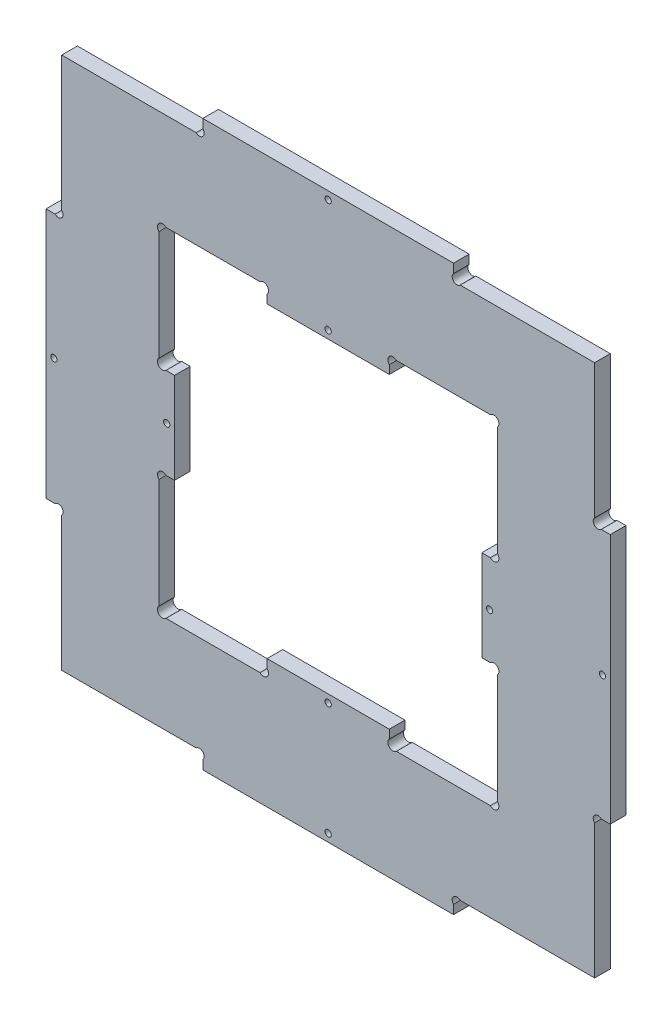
SolidWorks part; units mm, degrees
ref_plane "Plan de face" through (0, 0, 0) normal (0, 0, 1) x (1, 0, 0)
ref_plane "Plan de dessus" through (0, 0, 0) normal (0, 1, 0) x (1, 0, 0)
ref_plane "Plan de droite" through (0, 0, 0) normal (1, 0, 0) x (0, 0, -1)
sketch "Esquisse1" plane through (0, 0, 0) normal (0, 0, 1) x (1, 0, 0)
  line L0 (71.1637, -114.0585) -> (71.1637, -111.1798)
  line L1 (-20.3363, -31.4726) -> (-20.3363, -21.1058) construction
  line L2 (22.9716, -75.5585) -> (35.3801, -75.5585) construction
  line L3 (-28.4521, -38.5585) -> (-1.3302, -38.5585) construction
  line L4 (11.6637, -82.4037) -> (11.6637, -56.2614) construction
  line L5 (-8.8363, 65.9415) -> (71.1637, 65.9415)
  line L6 (-58.8363, 15.9415) -> (-58.8363, -64.0585)
  line L7 (-8.8363, -114.0585) -> (71.1637, -114.0585)
  line L8 (121.1637, 15.9415) -> (121.1637, -64.0585)
  line L9 (73.285, -109.0585) -> (116.1637, -109.0585)
  line L10 (116.1637, -109.0585) -> (116.1637, -66.1798)
  line L11 (118.285, -64.0585) -> (121.1637, -64.0585)
  line L12 (-8.8363, -114.0585) -> (-8.8363, -111.1798)
  line L13 (-10.9576, -109.0585) -> (-53.8363, -109.0585)
  line L14 (-53.8363, -109.0585) -> (-53.8363, -66.1798)
  line L15 (-55.9576, -64.0585) -> (-58.8363, -64.0585)
  line L16 (-58.8363, 15.9415) -> (-55.9576, 15.9415)
  line L17 (-53.8363, 18.0628) -> (-53.8363, 60.9415)
  line L18 (-53.8363, 60.9415) -> (-10.9576, 60.9415)
  line L19 (-8.8363, 63.0628) -> (-8.8363, 65.9415)
  line L20 (71.1637, 65.9415) -> (71.1637, 63.0628)
  line L21 (73.285, 60.9415) -> (116.1637, 60.9415)
  line L22 (116.1637, 60.9415) -> (116.1637, 18.0628)
  line L23 (118.285, 15.9415) -> (121.1637, 15.9415)
  line L24 (-8.8363, 60.9415) -> (-12.1872, 64.2924) construction
  line L25 (71.1637, 60.9415) -> (74.5147, 64.2924) construction
  line L26 (116.1637, 15.9415) -> (119.3654, 19.1431) construction
  line L27 (116.1637, -64.0585) -> (119.1916, -67.0864) construction
  line L28 (71.1637, -109.0585) -> (74.5147, -112.4095) construction
  line L29 (-8.8363, -109.0585) -> (-11.7026, -111.9249) construction
  line L30 (-53.8363, -64.0585) -> (-56.8641, -67.0864) construction
  line L31 (-53.8363, 15.9415) -> (-56.8641, 18.9693) construction
  line L32 (35.3801, -73.0585) -> (9.1798, -73.0585) construction
  line L33 (11.6637, 24.9415) -> (11.6637, 27.6787)
  line L34 (-20.5735, 29.9415) -> (9.401, 29.9415)
  line L35 (-22.8363, -7.2958) -> (-22.8363, 27.6787)
  line L36 (-17.8363, -9.5585) -> (-20.5735, -9.5585)
  line L37 (11.6637, -73.0585) -> (11.6637, -75.7958)
  line L38 (-17.8363, -38.5585) -> (-20.5735, -38.5585)
  line L39 (80.1637, -9.5585) -> (82.901, -9.5585)
  line L40 (85.1637, -7.2958) -> (85.1637, 27.6787)
  line L41 (-22.8363, -38.5585) -> (-16.392, -45.0028) construction
  line L42 (82.901, 29.9415) -> (52.9265, 29.9415)
  line L43 (50.6637, 24.9415) -> (50.6637, 27.6787)
  line L44 (50.6637, -73.0585) -> (50.6637, -75.7958)
  line L45 (82.901, -78.0585) -> (52.9265, -78.0585)
  line L46 (85.1637, -40.8213) -> (85.1637, -75.7958)
  line L47 (80.1637, -38.5585) -> (82.901, -38.5585)
  line L48 (-17.8363, -9.5585) -> (-17.8363, -38.5585)
  line L49 (11.6637, 24.9415) -> (50.6637, 24.9415)
  line L50 (11.6637, -78.0585) -> (2.6519, -69.0467) construction
  line L51 (80.1637, -9.5585) -> (80.1637, -38.5585)
  line L52 (50.6637, -73.0585) -> (11.6637, -73.0585)
  line L53 (-17.8363, -54.6638) -> (-17.8363, -4.0404) construction
  line L55 (-22.8363, -78.0585) -> (-13.8443, -69.0665) construction
  line L56 (-22.8363, -40.8213) -> (-22.8363, -75.7958)
  line L57 (-20.5735, -78.0585) -> (9.401, -78.0585)
  line L64 (-8.8363, 65.9415) -> (71.1637, 60.9415) construction
  line L65 (116.1637, 15.9415) -> (121.1637, -64.0585) construction
  line L66 (-8.8363, -114.0585) -> (71.1637, -109.0585) construction
  line L67 (-58.8363, 15.9415) -> (-53.8363, -64.0585) construction
  line L68 (31.1637, 65.9415) -> (31.1637, -114.0585) construction
  line L69 (121.1637, -24.0585) -> (-58.8363, -24.0585) construction
  line L70 (116.1637, -116.9858) -> (116.1637, 83.343) construction
  line L71 (123.2038, -109.0585) -> (-108.068, -109.0585) construction
  line L72 (85.1637, -83.805) -> (85.1637, 64.6879) construction
  line L73 (-22.8363, -83.805) -> (-22.8363, 42.8082) construction
  line L74 (95.2149, 29.9415) -> (-41.1378, 29.9415) construction
  line L75 (95.2149, -78.0585) -> (-41.1378, -78.0585) construction
  arc A0 (73.4265, -109.0585) -> (71.1637, -111.3213) centre (72.2951, -110.1899) ccw construction
  arc A1 (71.1637, 63.2042) -> (73.4265, 60.9415) centre (72.2951, 62.0728) ccw construction
  arc A2 (-10.9576, 60.9415) -> (-8.8363, 63.0628) centre (-9.8969, 62.0021) ccw
  arc A3 (71.1637, 63.0628) -> (73.285, 60.9415) centre (72.2244, 62.0021) ccw
  arc A4 (116.1637, 18.0628) -> (118.285, 15.9415) centre (117.2244, 17.0021) ccw
  arc A5 (118.285, -64.0585) -> (116.1637, -66.1798) centre (117.2244, -65.1192) ccw
  arc A6 (73.285, -109.0585) -> (71.1637, -111.1798) centre (72.2244, -110.1192) ccw
  arc A7 (-8.8363, -111.1798) -> (-10.9576, -109.0585) centre (-9.8969, -110.1192) ccw
  arc A8 (-53.8363, -66.1798) -> (-55.9576, -64.0585) centre (-54.8969, -65.1192) ccw
  arc A9 (-55.9576, 15.9415) -> (-53.8363, 18.0628) centre (-54.8969, 17.0021) ccw
  arc A10 (9.401, 29.9415) -> (11.6637, 27.6787) centre (10.5324, 28.8101) cw
  arc A11 (-22.8363, 27.6787) -> (-20.5735, 29.9415) centre (-21.7049, 28.8101) cw
  circle A12 centre (31.1637, -75.5585) radius 1
  circle A13 centre (-20.3363, -24.0585) radius 1
  arc A14 (-20.5735, -9.5585) -> (-22.8363, -7.2958) centre (-21.7049, -8.4272) cw
  arc A15 (82.901, -9.5585) -> (85.1637, -7.2958) centre (84.0324, -8.4272) ccw
  arc A16 (85.1637, 27.6787) -> (82.901, 29.9415) centre (84.0324, 28.8101) ccw
  arc A17 (52.9265, 29.9415) -> (50.6637, 27.6787) centre (51.7951, 28.8101) ccw
  arc A18 (52.9265, -78.0585) -> (50.6637, -75.7958) centre (51.7951, -76.9272) cw
  arc A19 (9.401, -78.0585) -> (11.6637, -75.7958) centre (10.5324, -76.9272) ccw
  arc A20 (-20.5735, -38.5585) -> (-22.8363, -40.8213) centre (-21.7049, -39.6899) ccw
  arc A21 (85.1637, -75.7958) -> (82.901, -78.0585) centre (84.0324, -76.9272) cw
  arc A22 (-22.8363, -75.7958) -> (-20.5735, -78.0585) centre (-21.7049, -76.9272) ccw
  arc A23 (82.901, -38.5585) -> (85.1637, -40.8213) centre (84.0324, -39.6899) cw
  circle A24 centre (31.1637, 27.4415) radius 1
  circle A25 centre (82.6637, -24.0585) radius 1
  circle A26 centre (-56.3363, -24.0585) radius 1
  circle A27 centre (31.1637, 63.4415) radius 1
  circle A28 centre (118.6637, -24.0585) radius 1
  circle A29 centre (31.1637, -111.5585) radius 1
  dimension "D9" = 5
  dimension "D13" = 14.5
  dimension "D4" = 45
  dimension "D36" = 85
  dimension "D10" = 5
  dimension "D5" = 45
  dimension "D6" = 2.5
  dimension "D7" = 2.5
  dimension "D8" = 19.5
  dimension "D12" = 45
  dimension "D25" = 54
  dimension "D26" = 54
  dimension "D27" = 54
  dimension "D37" = 85
  dimension "D38" = 54
extrude "Boss.-Extru.1" add sketch "Esquisse1" along normal blind 5
